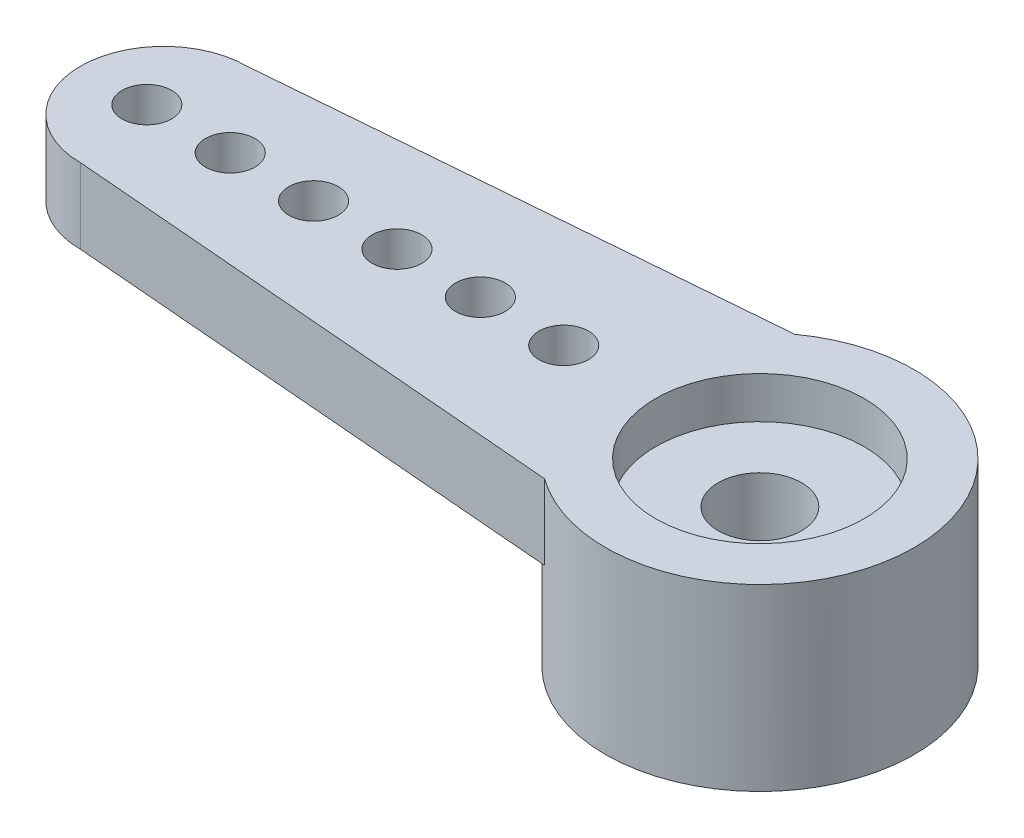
SolidWorks part; units mm, degrees
ref_plane "Alzado" through (0, 0, 0) normal (0, 0, 1) x (1, 0, 0)
ref_plane "Planta" through (0, 0, 0) normal (0, 1, 0) x (1, 0, 0)
ref_plane "Vista lateral" through (0, 0, 0) normal (1, 0, 0) x (0, 0, -1)
sketch "Croquis1" plane through (0, 0, 0) normal (0, 1, 0) x (1, 0, 0)
  circle A0 centre (0, 0) radius 3.7
  dimension "D1" = 7.4
extrude "Saliente-Extruir2" add sketch "Croquis1" along normal blind 4.3 contours A0
sketch "Croquis2" plane through (0, 0, 0) normal (0, -1, 0) x (1, 0, 0)
  circle A0 centre (0, 0) radius 2.5
  dimension "D1" = 5
extrude "Cortar-Extruir1" cut sketch "Croquis2" against normal blind 1.5
sketch "Croquis3" plane through (0, 4.3, 0) normal (0, 1, 0) x (1, 0, 0)
  circle A0 centre (0, 0) radius 2.5
  dimension "D1" = 5
extrude "Cortar-Extruir2" cut sketch "Croquis3" against normal blind 1
sketch "Croquis4" plane through (0, 3.3, 0) normal (0, 1, 0) x (1, 0, 0)
  circle A0 centre (0, 0) radius 1
  dimension "D1" = 2
extrude "Cortar-Extruir3" cut sketch "Croquis4" against normal blind 1.8
sketch "Croquis5" plane through (0, 4.3, 0) normal (0, 1, 0) x (1, 0, 0)
  line L0 (0, 0) -> (-2.1656, 0) construction
  line L1 (-2.1656, 3) -> (-3.1202, 0)
  line L2 (-3.1202, 0) -> (-2.1656, -3)
  line L3 (-2.1656, 0) -> (-2.5, 0) construction
  line L4 (-3.7, 0) -> (-16.3, 0) construction
  line L5 (-14.3, 0) -> (-14.3, 2) construction
  line L6 (-14.3, 0) -> (-14.3, -2) construction
  line L7 (-2.1656, 3) -> (-14.3, 2)
  line L8 (-2.1656, -3) -> (-14.3, -2)
  arc A0 (-14.3, 2) -> (-14.3, -2) centre (-14.3, 0) ccw
  circle A3 centre (0, 0) radius 3.7 construction
  circle A4 centre (0, 0) radius 2.5 construction
  point P2 (-14.3, 0)
  dimension "D1" = 2.1656
  dimension "D2" = 12.6
  dimension "D3" = 2
  dimension "D4" = 2
  dimension "D5" = 2
extrude "Saliente-Extruir3" add sketch "Croquis5" against normal blind 1.8
sketch "Croquis6" plane through (0, 4.3, 0) normal (0, 1, 0) x (1, 0, 0)
  line L0 (0, 0) -> (-16.3, 0) construction
  line L1 (2, 0) -> (-14.3, 0) construction
  line L2 (4, 0) -> (-12.3, 0) construction
  line L3 (6, 0) -> (-10.3, 0) construction
  line L4 (8, 0) -> (-8.3, 0) construction
  line L5 (10, 0) -> (-6.3, 0) construction
  arc A0 (-14.3, 2) -> (-14.3, -2) centre (-14.3, 0) ccw construction
  circle A1 centre (-14.705, 0) radius 0.595
  circle A2 centre (-12.705, 0) radius 0.595
  circle A3 centre (-10.705, 0) radius 0.595
  circle A4 centre (-8.705, 0) radius 0.595
  circle A5 centre (-6.705, 0) radius 0.595
  circle A6 centre (-4.705, 0) radius 0.595
  point P6 (-14.705, 0)
  dimension "D2" = 1.19
  dimension "D1" = 1.595
  dimension "D3" = 6
extrude "Cortar-Extruir4" cut sketch "Croquis6" against normal blind 1.8
